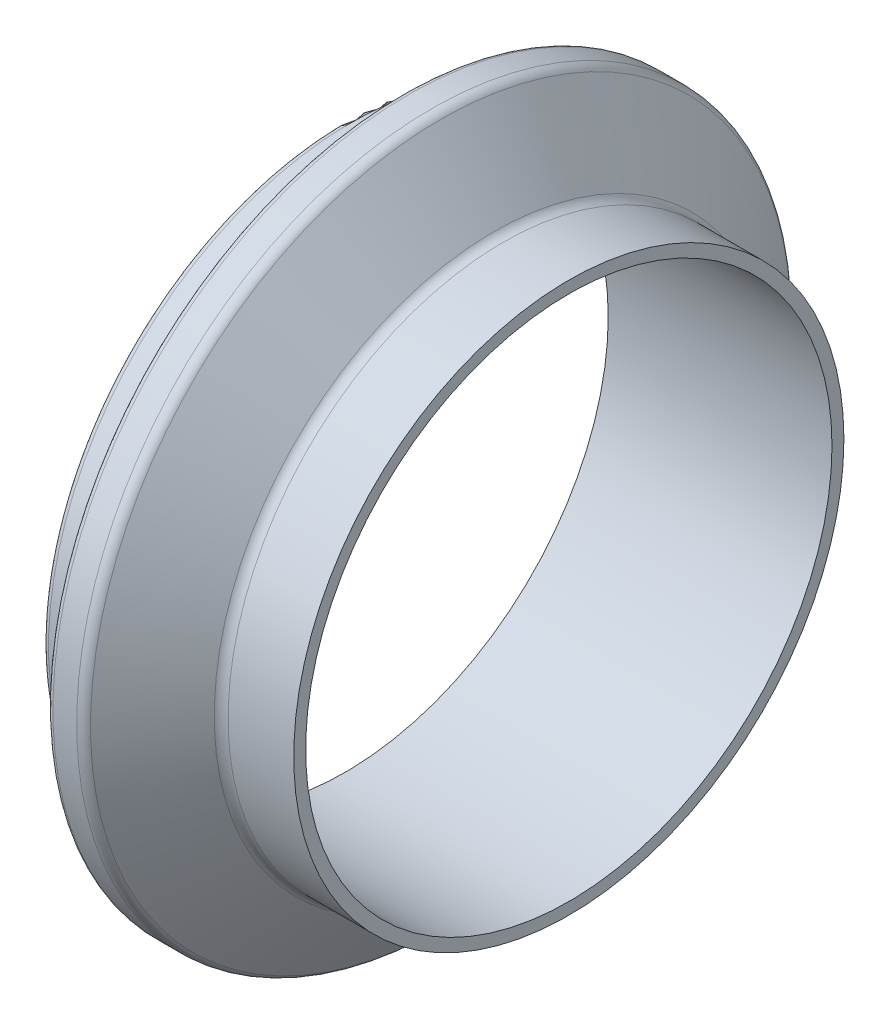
SolidWorks part; units mm, degrees
ref_plane "Front Plane" through (0, 0, 0) normal (0, 0, 1) x (1, 0, 0)
ref_plane "Top Plane" through (0, 0, 0) normal (0, 1, 0) x (1, 0, 0)
ref_plane "Right Plane" through (0, 0, 0) normal (1, 0, 0) x (0, 0, -1)
sketch "Sketch1" plane through (0, 0, 0) normal (0, 0, 1) x (1, 0, 0)
  line L0 (0, 0) -> (-37.0343, 0) construction
  line L1 (0, 36.449) -> (-30.988, 36.449)
  line L2 (-30.988, 36.449) -> (-30.988, 41.0718)
  line L3 (-30.1752, 41.8846) -> (-23.9268, 41.8846)
  line L4 (-23.114, 42.6974) -> (-23.114, 48.3362)
  line L5 (-22.3012, 49.149) -> (-19.0096, 49.149)
  line L6 (-17.7317, 48.5118) -> (-10.3659, 38.7372)
  line L7 (-9.088, 38.1) -> (0, 38.1)
  line L8 (0, 38.1) -> (0, 36.449)
  arc A0 (-22.3012, 49.149) -> (-23.114, 48.3362) centre (-22.3012, 48.3362) ccw
  arc A1 (-23.114, 42.6974) -> (-23.9268, 41.8846) centre (-23.9268, 42.6974) cw
  arc A2 (-30.1752, 41.8846) -> (-30.988, 41.0718) centre (-30.1752, 41.0718) ccw
  arc A3 (-9.088, 38.1) -> (-10.3659, 38.7372) centre (-9.088, 39.7002) cw
  arc A4 (-17.7317, 48.5118) -> (-19.0096, 49.149) centre (-19.0096, 47.5488) ccw
  point P13 (-23.114, 49.149)
  point P18 (-30.988, 41.8846)
  point P23 (-18.2118, 49.149)
  dimension "D7" = 0.8128
  dimension "D8" = 1.6002
  dimension "D1" = 36.449
  dimension "D2" = 38.1
  dimension "D3" = 49.149
  dimension "D4" = 41.8846
  dimension "D5" = 4.9022
  dimension "D6" = 7.874
  dimension "D9" = 30.988
revolve "Revolve1" add sketch "Sketch1" angle 360 about L0
